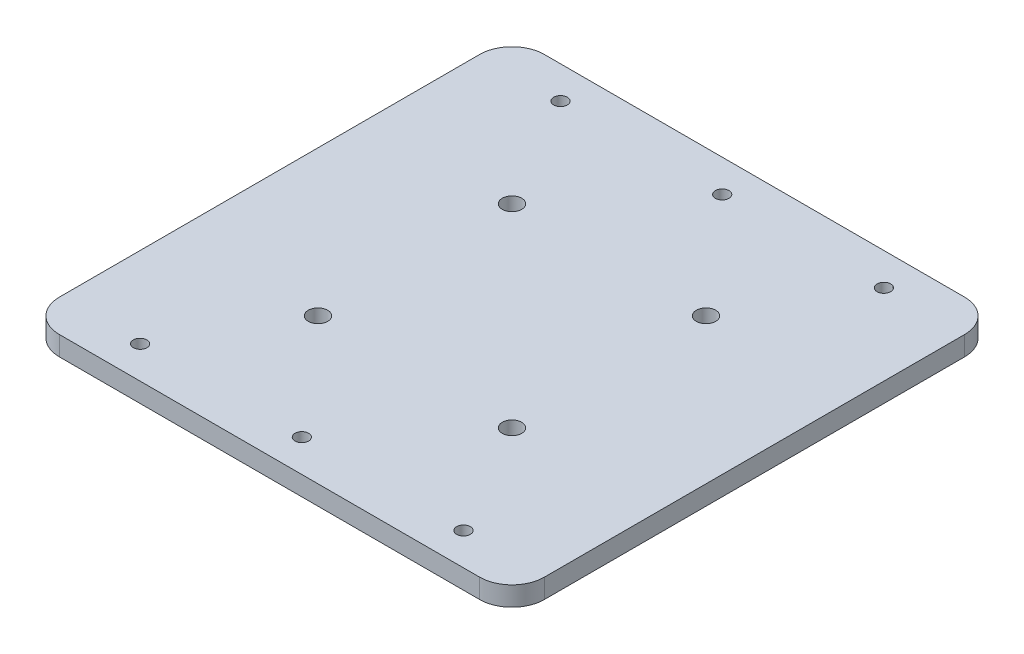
SolidWorks part; units mm, degrees
ref_plane "前视基准面" through (0, 0, 0) normal (0, 0, 1) x (1, 0, 0)
ref_plane "上视基准面" through (0, 0, 0) normal (0, 1, 0) x (1, 0, 0)
ref_plane "右视基准面" through (0, 0, 0) normal (1, 0, 0) x (0, 0, -1)
sketch "草图1" plane through (0, 0, 0) normal (0, 1, 0) x (1, 0, 0)
  line L1 (-75, -75) -> (75, -75)
  line L2 (-75, -75) -> (-75, 75)
  line L3 (-75, 75) -> (75, 75)
  line L4 (75, -75) -> (75, 75)
  line L5 (-75, -75) -> (75, 75) construction
  line L6 (-75, 75) -> (75, -75) construction
  point P0 (0, 0)
  dimension "D1" = 150
  dimension "D2" = 150
extrude "凸台-拉伸1" add sketch "草图1" along normal blind 6
sketch "草图2" plane through (0, 6, 0) normal (0, 1, 0) x (1, 0, 0)
  line L1 (-30, -30) -> (30, -30) construction
  line L2 (-30, -30) -> (-30, 30) construction
  line L3 (-30, 30) -> (30, 30) construction
  line L4 (30, -30) -> (30, 30) construction
  line L5 (-30, -30) -> (30, 30) construction
  line L6 (-30, 30) -> (30, -30) construction
  circle A0 centre (-30, 30) radius 3
  circle A1 centre (30, 30) radius 3
  circle A2 centre (30, -30) radius 3
  circle A3 centre (-30, -30) radius 3
  point P0 (0, 0)
  dimension "D3" = 6
  dimension "D1" = 60
  dimension "D2" = 60
extrude "切除-拉伸1" cut sketch "草图2" against normal through all
sketch "草图3" plane through (0, 0, 0) normal (0, -1, 0) x (1, 0, 0)
  line L0 (-75, 75) -> (75, 75) construction
  line L1 (0, 0) -> (46.1639, 0) construction
  circle A0 centre (0, 65) radius 2
  circle A1 centre (50, 65) radius 2
  circle A2 centre (-50, 65) radius 2
  circle A3 centre (-50, -65) radius 2
  circle A4 centre (50, -65) radius 2
  circle A5 centre (0, -65) radius 2
  dimension "D1" = 4
  dimension "D4" = 10
  dimension "D2" = 2
  dimension "D3" = 2
extrude "切除-拉伸2" cut sketch "草图3" against normal blind 6
sketch "草图5" plane through (0, 0, 0) normal (0, -1, 0) x (1, 0, 0)
  line L0 (0, 0) -> (34.553, 0) construction
  circle A0 centre (-50, 65) radius 4
  circle A1 centre (0, 65) radius 4
  circle A2 centre (50, 65) radius 4
  circle A3 centre (50, -65) radius 4
  circle A4 centre (0, -65) radius 4
  circle A5 centre (-50, -65) radius 4
  dimension "D1" = 8
extrude "切除-拉伸3" cut sketch "草图5" against normal blind 3
fillet "圆角1" radius 10 4 edges at (75, 3, 75) (-75, 3, -75) (75, 3, -75) (-75, 3, 75)
sketch "草图6" plane through (0, 0, 0) normal (0, -1, 0) x (1, 0, 0)
  line L0 (-55, -30) -> (-55, 30) construction
  line L1 (-65, -30) -> (-65, 30)
  line L2 (-45, -30) -> (-45, 30)
  line L3 (-75, -65) -> (-75, 65) construction
  line L4 (-20, 45) -> (20, 45) construction
  line L5 (-20, 55) -> (20, 55)
  line L6 (-20, 35) -> (20, 35)
  line L7 (0, 0) -> (28.2579, 0) construction
  line L8 (0, 0) -> (0, 18.6055) construction
  line L9 (55, -30) -> (55, 30) construction
  line L10 (65, -30) -> (65, 30)
  line L11 (45, -30) -> (45, 30)
  line L12 (-20, -45) -> (20, -45) construction
  line L13 (-20, -55) -> (20, -55)
  line L14 (-20, -35) -> (20, -35)
  circle A0 centre (0, 0) radius 25
  arc A1 (-65, -30) -> (-45, -30) centre (-55, -30) ccw
  arc A2 (-45, 30) -> (-65, 30) centre (-55, 30) ccw
  arc A3 (-20, 55) -> (-20, 35) centre (-20, 45) ccw
  arc A4 (20, 35) -> (20, 55) centre (20, 45) ccw
  arc A5 (65, -30) -> (45, -30) centre (55, -30) cw
  arc A6 (45, 30) -> (65, 30) centre (55, 30) cw
  arc A7 (-20, -55) -> (-20, -35) centre (-20, -45) cw
  arc A8 (20, -35) -> (20, -55) centre (20, -45) cw
  point P5 (-55, 0)
  point P14 (0, 45)
  point P23 (55, 0)
  point P30 (0, -45)
  dimension "D1" = 50
  dimension "D3" = 10
  dimension "D4" = 60
  dimension "D5" = 10
  dimension "D2" = 10
  dimension "D6" = 40
  dimension "D7" = 45
extrude "切除-拉伸4" cut sketch "草图6" against normal blind 4
fillet "圆角2" radius 2 23 edges at (30, 0, -45) (0, 0, -55) (-30, 0, -45) (55, 0, 40) (65, 0, 0) (55, 0, -40) (0, 0, 55) (30, 0, 45) (0, 0, 35) (-45, 0, 0) (-55, 0, -40) (-65, 0, 0) (-50, 0, 61) (50, 0, 61) (0, 0, 61) (50, 0, -61) (0, 0, -61) (-50, 0, -61) (0, 0, -35) (45, 0, 0) (0, 0, -25) (-30, 0, 45) (-55, 0, 40)
sketch "草图7" plane through (0, 6, 0) normal (0, 1, 0) x (1, 0, 0)
  line L0 (0, 0) -> (30.9134, 0) construction
  circle A0 centre (-50, 65) radius 2.1
  circle A1 centre (0, 65) radius 2.1
  circle A2 centre (50, 65) radius 2.1
  circle A3 centre (50, -65) radius 2.1
  circle A4 centre (0, -65) radius 2.1
  circle A5 centre (-50, -65) radius 2.1
  dimension "D1" = 4.2
extrude "切除-拉伸5" cut sketch "草图7" against normal blind 4
